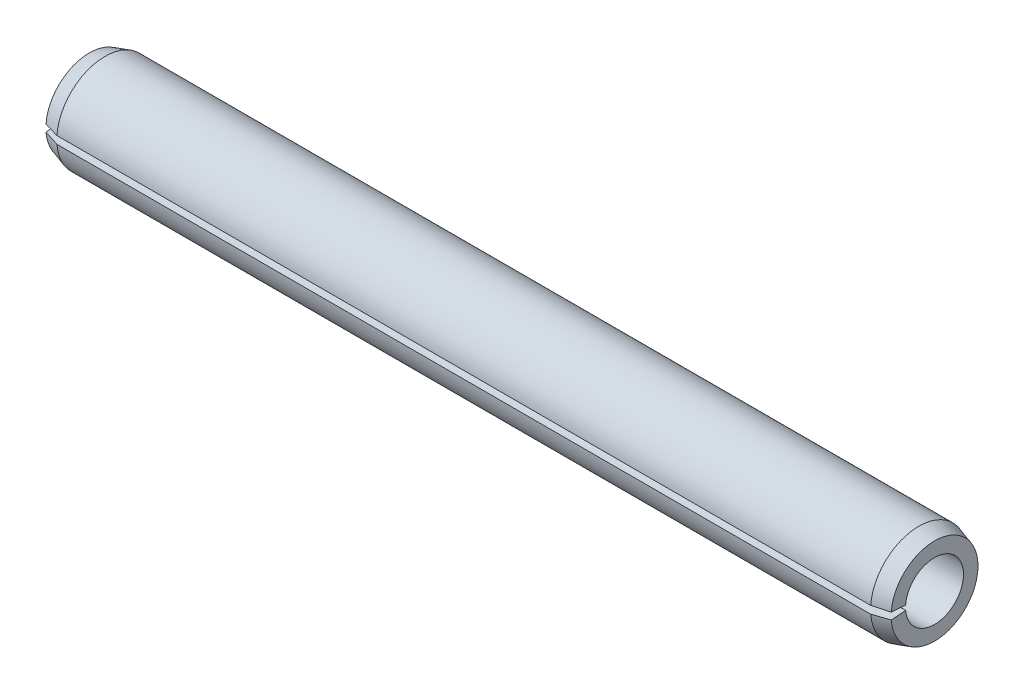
SolidWorks part; units mm, degrees
ref_plane "Plane1" through (0, 0, 0) normal (0, 0, 1) x (1, 0, 0)
ref_plane "Plane2" through (0, 0, 0) normal (0, 1, 0) x (1, 0, 0)
ref_plane "Plane3" through (0, 0, 0) normal (1, 0, 0) x (0, 0, -1)
sketch "Sketch1" plane through (0, 0, 0) normal (0, 0, 1) x (1, 0, 0)
  line L0 (-9.525, 0) -> (111.125, 0) construction
  line L1 (0, 1.2) -> (35, 1.2)
  line L2 (35, 1.2) -> (35, 1.8)
  line L3 (35, 1.8) -> (34.35, 2)
  line L4 (34.35, 2) -> (0.65, 2)
  line L5 (0.65, 2) -> (0, 1.8)
  line L7 (0, 1.8) -> (0, 1.2)
  dimension "D1" = 3.6
  dimension "D2" = 3.6
  dimension "Diameter" = 4
  dimension "D3" = 0.65
  dimension "Length" = 35
  dimension "Thickness" = 0.8
  dimension "Chamfer_len" = 0.65
revolve "Base-Revolve" add sketch "Sketch1" angle 360 about L0
sketch "Sketch2" plane through (0, 0, 0) normal (-1, 0, 0) x (0, -1, 0)
  line L0 (0, 0) -> (0.1601, 2.0337)
  line L1 (0, -3.175) -> (0, 12.7) construction
  line L2 (0, 0) -> (-0.1601, 2.0337)
  arc A0 (0.1601, 2.0337) -> (-0.1601, 2.0337) centre (0, 0) ccw
  dimension "D1" = 2.04
  dimension "Gap_ang" = 9
extrude "Gap" cut sketch "Sketch2" against normal through all
equation "\"D1@Sketch2\" = \"Diameter@Sketch1\" * 0.51"
equation "\"D1@Sketch1\" = \"Diameter@Sketch1\" -  ( \"Thickness@Sketch1\" / 2 ) "
equation "\"D2@Sketch1\" = \"D1@Sketch1\""
equation "\"D3@Sketch1\" = \"Chamfer_len@Sketch1\""
